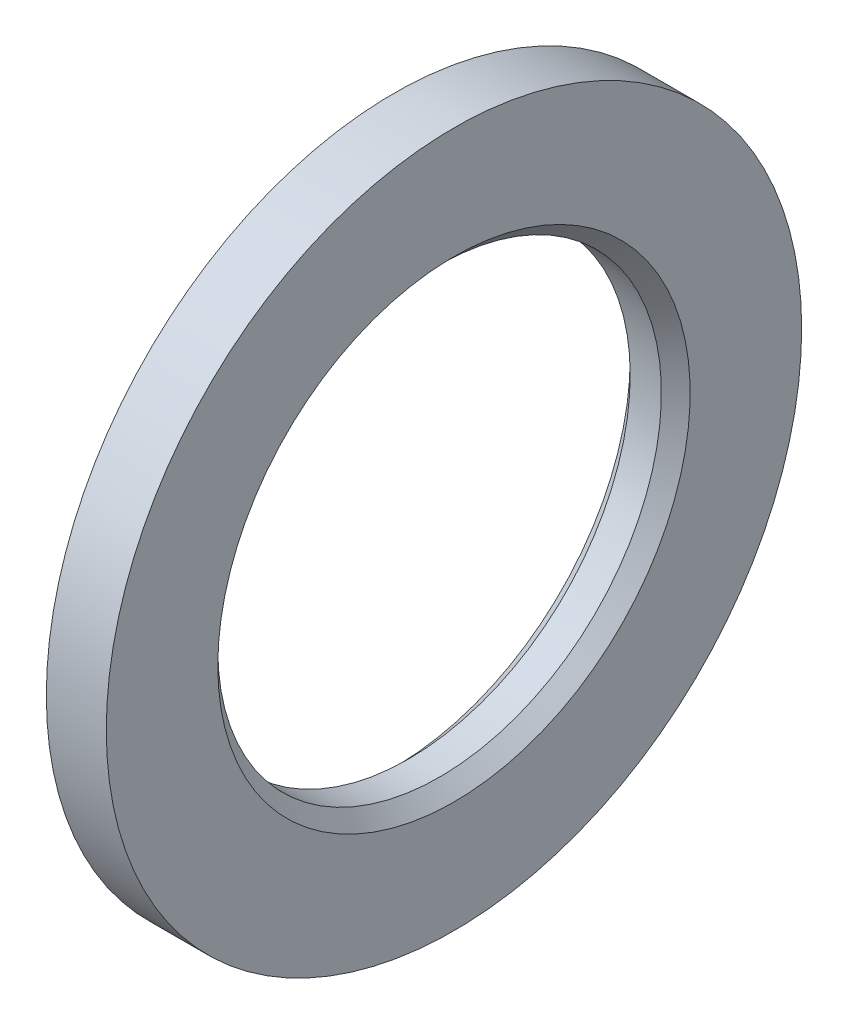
SolidWorks part; units mm, degrees
ref_plane "Plane1" through (0, 0, 0) normal (0, 0, 1) x (1, 0, 0)
ref_plane "Plane2" through (0, 0, 0) normal (0, 1, 0) x (1, 0, 0)
ref_plane "Plane3" through (0, 0, 0) normal (1, 0, 0) x (0, 0, -1)
other "Configuration Table"
sketch "Sketch1" plane through (0, 0, 0) normal (0, 0, 1) x (1, 0, 0)
  line L0 (-34.925, 0) -> (9.525, 0) construction
  line L1 (0, 18.5) -> (0, 29)
  line L2 (0, 29) -> (-5, 29)
  line L3 (-5, 29) -> (-5, 18.5)
  line L4 (-5, 18.5) -> (0, 18.5)
  dimension "Thickness" = 5
  dimension "Inside_dia" = 37
  dimension "Outside_dia" = 58
revolve "Base-Revolve" add sketch "Sketch1" angle 360 about L0
chamfer "IDChamfer" distance 1.2 angle 45 1 edges at (0, 0, 18.5)
chamfer "IDChamferFar" distance 1.2 angle 45 1 edges at (-5, 0, 18.5)
equation "\"D1@IDChamferFar\" =  \"Chamfer_width@IDChamfer\""
